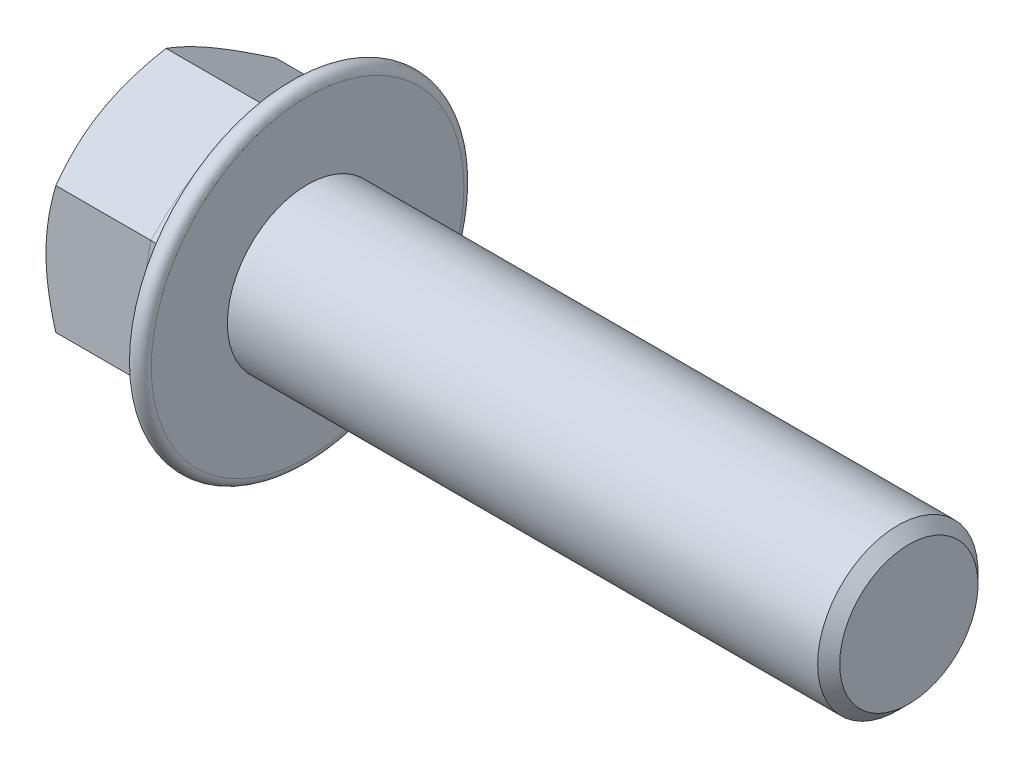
SolidWorks part; units mm, degrees
ref_plane "Plane1" through (0, 0, 0) normal (0, 0, 1) x (1, 0, 0)
ref_plane "Plane2" through (0, 0, 0) normal (0, 1, 0) x (1, 0, 0)
ref_plane "Plane3" through (0, 0, 0) normal (1, 0, 0) x (0, 0, -1)
sketch "Sketch1" plane through (0, 0, 0) normal (1, 0, 0) x (0, 0, -1)
  line L0 (11, 6.3509) -> (11, -6.3509)
  line L1 (-11, 6.3509) -> (-11, -6.3509)
  line L2 (11, -6.3509) -> (0, -12.7017)
  line L3 (0, -12.7017) -> (-11, -6.3509)
  line L4 (11, 6.3509) -> (0, 12.7017)
  line L5 (0, 12.7017) -> (-11, 6.3509)
  dimension "Width_flats" = 22
  dimension "D2" = 120
  dimension "D3" = 11
  dimension "D4" = 11
  dimension "D5" = 11
extrude "BaseHead" add sketch "Sketch1" along normal blind 15.1
sketch "BodySke" plane through (0, 0, 0) normal (0, 0, 1) x (1, 0, 0)
  line L0 (0, 6.3509) -> (0, -6.3509) construction
  line L1 (0, 0) -> (75.1, 0)
  line L2 (0, 0) -> (0, 8)
  line L3 (0, 8) -> (73.9985, 8)
  line L4 (75.1, 0) -> (75.1, 6.8985)
  line L5 (15.1, 12.7017) -> (15.1, 6.3509) construction
  line L6 (75.1, 6.8985) -> (73.9985, 8)
  line L7 (0, 0) -> (96.52, 0) construction
  line L8 (75.1, -6.8985) -> (73.9985, -8) construction
  line L9 (0, -8) -> (73.9985, -8) construction
  line L10 (17.1, 15.24) -> (17.1, -1.27) construction
  line L11 (37.1, 15.24) -> (37.1, -1.27) construction
  line L12 (15.1, 6.3509) -> (15.1, -6.3509) construction
  dimension "Length" = 60
  dimension "Body_ch_ang" = 45
  dimension "Diameter" = 16
  dimension "Minor_dia" = 13.797
  dimension "Advance" = 2
  dimension "Thread_nom" = 38
revolve "BaseBody" add sketch "BodySke"
fillet "HeadFillet" [suppressed] radius 0.8
sketch "Sketch3" plane through (0, 0, 0) normal (0, 0, 1) x (1, 0, 0)
  line L0 (0, 11) -> (3.8692, 17.7017)
  line L1 (0, 12.7017) -> (0, 6.3509) construction
  line L2 (3.8692, 17.7017) -> (3.8692, 22.7017)
  line L3 (3.8692, 22.7017) -> (-10, 22.7017)
  line L4 (-10, 22.7017) -> (-10, 11)
  line L5 (-10, 11) -> (0, 11)
  line L6 (0, 0) -> (99.06, 0) construction
  line L7 (15.1, 12.7017) -> (0, 12.7017) construction
  dimension "D1" = 11
  dimension "D2" = 5
  dimension "D3" = 10
  dimension "D4" = 5
  dimension "Head_ch_ang" = 30
revolve "HeadChamfer" cut sketch "Sketch3" angle 360 about L6
sketch "Sketch4" plane through (0, 0, 0) normal (0, 0, 1) x (1, 0, 0)
  line L0 (5.9326, 0) -> (13.3843, 15.9804)
  line L1 (15.1, 12.7017) -> (15.1, 6.3509) construction
  line L2 (13.3, 34.3444) -> (13.3, 16.9779) construction
  line L3 (15.1, 0) -> (15.1, 15.6)
  line L4 (8.3021, 16.5) -> (20.1618, 16.5) construction
  line L5 (0, 0) -> (95.25, 0) construction
  line L6 (0, 0) -> (96.52, 0) construction
  line L7 (5.9326, 0) -> (15.1, 0)
  line L8 (8.3021, -16.5) -> (20.1618, -16.5) construction
  arc A0 (15.1, 15.6) -> (13.3843, 15.9804) centre (14.2, 15.6) ccw
  dimension "D1" = 25
  dimension "Flange_thickness" = 1.8
  dimension "Flange_dia" = 33
revolve "Flange" add sketch "Sketch4" angle 360 about L5
fillet "FlangeHexFillet" radius 2 6 edges at (11.2438, 11.0037, -2.941) (11.2438, 8.0488, 8.059) (11.2438, -11.0037, 2.941) (11.2438, -8.0488, -8.059)
sketch "ThdSchSke" plane through (0, 0, 0) normal (0, 0, 1) x (1, 0, 0)
  line L0 (37.1, -6.8985) -> (36.3287, -8)
  line L1 (37.1, -6.8985) -> (37.8713, -8)
  line L2 (37.8713, -8) -> (37.8713, -10)
  line L3 (-3.175, 0) -> (5.1513, 0) construction
  line L5 (37.8713, -10) -> (36.3287, -10)
  line L6 (36.3287, -10) -> (36.3287, -8)
  dimension "Thread_minor" = 13.797
  dimension "Diameter" = 16
  dimension "Start" = 37.1
  dimension "SideAngle" = 55
  dimension "VeeAngle" = 70
  dimension "Overcut" = 20
revolve "ThreadSchematic" [suppressed] cut sketch "ThdSchSke" angle 360 about L3
pattern_linear "ThdSchPat" [suppressed]
equation "\"D3@Sketch1\" = \"Width_flats@Sketch1\" / 2"
equation "\"D4@Sketch1\" = \"D3@Sketch1\""
equation "\"D5@Sketch1\" = \"D4@Sketch1\""
equation "\"Thread_minor@ThreadCosmetic\" = \"Minor_dia@BodySke\""
equation "\"D1@Sketch3\" = \"Width_flats@Sketch1\" / 2"
equation "\"Thread_length@ThreadCosmetic\" = ((sgn( (\"Length@BodySke\" - \"Advance@BodySke\" * 2 ) - \"Thread_nom@BodySke\" )-1)*( (\"Length@BodySke\" - \"Advance@BodySke\" * 2 ) - \"Thread_nom@BodySke\" ))/-2+ \"Thread_nom@"
equation "\"Thread_minor@ThdSchSke\" = \"Minor_dia@BodySke\""
equation "\"Diameter@ThdSchSke\" = \"Diameter@BodySke\""
equation "\"Overcut@ThdSchSke\" = \"Diameter@BodySke\" * 1.25"
equation "\"Start@ThdSchSke\" = \"Head_ht@BaseHead\" + \"Length@BodySke\" - \"Thread_length@ThreadCosmetic\"  '---Non-countersunk---"
equation "\"Num_threads@ThdSchPat\" = int( \"Thread_length@ThreadCosmetic\" / \"Advance@BodySke\" + 0.999 )  + 1"
equation "\"Advance@ThdSchPat\" = \"Thread_length@ThreadCosmetic\" /  (\"Num_threads@ThdSchPat\" - 1) 'relax it"
equation "\"Num_threads@ThdSchPat\" = \"Num_threads@ThdSchPat\" - sgn( \"Num_threads@ThdSchPat\" - 1) '---chamfered tips only---"
